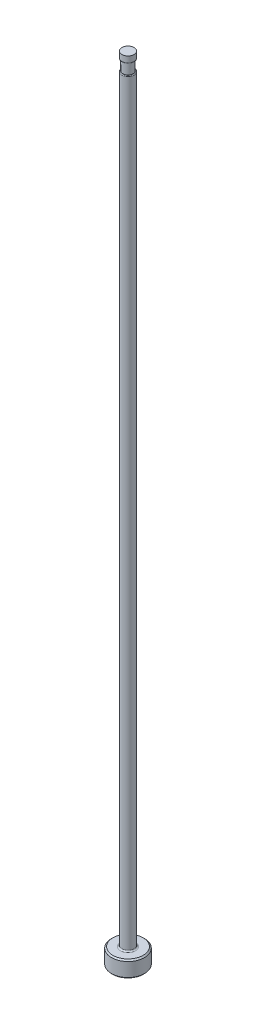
SolidWorks part; units mm, degrees
ref_plane "Front Plane" through (0, 0, 0) normal (0, 0, 1) x (1, 0, 0)
ref_plane "Top Plane" through (0, 0, 0) normal (0, 1, 0) x (1, 0, 0)
ref_plane "Right Plane" through (0, 0, 0) normal (1, 0, 0) x (0, 0, -1)
other "Configuration Table"
sketch "Sketch1" plane through (0, 0, 0) normal (0, 0, 1) x (1, 0, 0)
  line L0 (0, 259.9588) -> (0, -15.1925) construction
  line L1 (0, 0) -> (-3.175, 0)
  line L2 (-3.175, 0) -> (-3.175, 3.175)
  line L3 (-3.175, 3.175) -> (-1.19, 3.175)
  line L4 (-1.19, 3.175) -> (-1.19, 152.4)
  line L5 (-1.19, 152.4) -> (0, 152.4)
  line L6 (0, 152.4) -> (0, 0)
  dimension "L" = 152.4
  dimension "H" = 6.35
  dimension "T" = 3.175
  dimension "D" = 2.38
revolve "Revolve1" add sketch "Sketch1" angle 360 about L0
chamfer "Chamfer1" distance 0.254 angle 45 2 edges at (0, 3.175, 3.175) (0, 0, 3.175)
fillet "Fillet1" radius 0.254 1 edges at (0, 3.175, 1.19)
sketch "Sketch2" plane through (0, 0, 0) normal (0, 0, 1) x (1, 0, 0)
  line L0 (-1.19, 152.4) -> (-1.19, 3.429) construction
  line L1 (-1.19, 151.13) -> (-0.9868, 151.13)
  line L2 (-1.19, 151.13) -> (-1.19, 149.098)
  line L3 (-1.19, 149.098) -> (-0.9868, 149.098)
  line L4 (-0.9868, 151.13) -> (-0.9868, 149.098)
  line L5 (1.19, 152.4) -> (-1.19, 152.4) construction
  line L6 (0, 153.4483) -> (0, 147.3282) construction
  dimension "D1" = 2.032
  dimension "N" = 1.27
  dimension "FD" = 0.2032
  dimension "D3" = 1.9736
revolve "Vent Relief" cut sketch "Sketch2" angle 360 about L6
sketch "Sketch3" plane through (0, 0, 0) normal (0, 0, 1) x (1, 0, 0)
  line L0 (-0.9868, 150.114) -> (-0.9868, 86.614)
  line L1 (-0.9868, 151.13) -> (-0.9868, 149.098) construction
  line L2 (-1.19, 149.098) -> (-1.19, 3.429) construction
  line L3 (-1.19, 85.4964) -> (-1.19, 150.114)
  line L4 (-1.19, 150.114) -> (-0.9868, 150.114)
  arc A0 (-0.9868, 86.614) -> (-1.19, 85.4964) centre (-4.1618, 86.614) cw
  dimension "D1" = 3.175
  dimension "D2" = 63.5
extrude "D-Slot" cut sketch "Sketch3" against normal through all both and the other way through all
sketch "Sketch5" plane through (0, 0, 0) normal (0, 0, 1) x (1, 0, 0)
  line L0 (-1.19, 151.13) -> (1.19, 151.13) construction
  line L1 (-1.19, 152.4) -> (-1.1773, 152.4)
  line L2 (-1.19, 152.4) -> (-1.19, 151.13)
  line L3 (-1.19, 151.13) -> (-1.1773, 151.13)
  line L4 (-1.1773, 152.4) -> (-1.1773, 151.13)
  line L5 (0, 152.6877) -> (0, 150.5771) construction
  dimension "VP" = 0.0127
revolve "Vent Diameter" cut sketch "Sketch5" angle 360 about L5
fillet "Fillet2" radius 0.127 2 edges at (1.19, 149.098, 0) (0, 151.13, 1.1773)
sketch "Pocket Sketch" plane through (0, 0, 0) normal (0, 0, 1) x (1, 0, 0)
  line L0 (-3.5719, 0) -> (-3.5719, 3.2004)
  line L1 (-3.5719, 3.2004) -> (-2.1504, 3.2004)
  line L2 (-1.3884, 3.9624) -> (-1.3884, 22.225)
  line L3 (-1.3884, 22.225) -> (0, 22.225)
  line L4 (0, 22.225) -> (0, 0)
  line L5 (0, 0) -> (-3.5719, 0)
  line L6 (0, 12.6104) -> (0, -2.4989) construction
  line L7 (-3.175, 2.921) -> (-3.175, 0.254) construction
  line L8 (2.921, 3.175) -> (-2.921, 3.175) construction
  line L9 (-1.19, 85.4964) -> (-1.19, 3.429) construction
  line L10 (-2.1504, 3.2004) -> (-1.3884, 3.9624)
  point P3 (-1.3884, 3.2004)
  dimension "D1" = 7.1437
  dimension "D2" = 0.3969
  dimension "D3" = 0.0254
  dimension "D4" = 0.1984
  dimension "D5" = 2.7769
  dimension "D6" = 22.225
